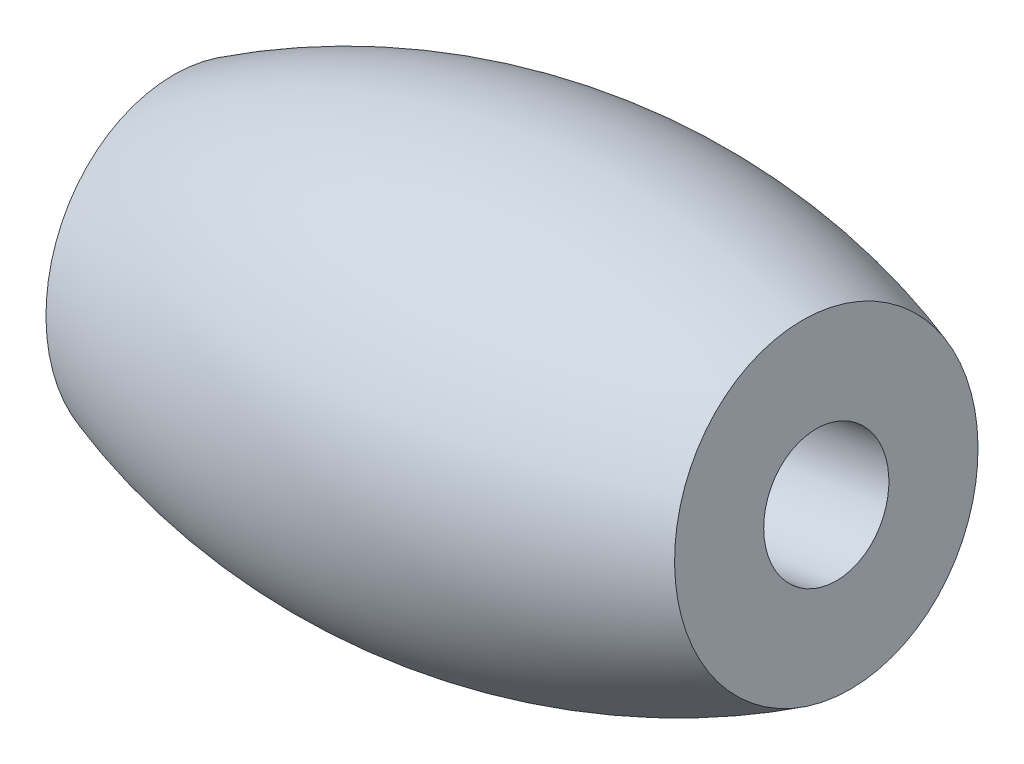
SolidWorks part; units mm, degrees
ref_plane "Plan de face" through (0, 0, 0) normal (0, 0, 1) x (1, 0, 0)
ref_plane "Plan de dessus" through (0, 0, 0) normal (0, 1, 0) x (1, 0, 0)
ref_plane "Plan de droite" through (0, 0, 0) normal (1, 0, 0) x (0, 0, -1)
sketch "Esquisse2" plane through (0, 0, 0) normal (0, 0, 1) x (1, 0, 0)
  line L1 (-28.3539, 9.813) -> (2.2832, 14.7694) construction
  line L2 (-21.6897, 12.5625) -> (-22.065, 14.8824)
  line L3 (-13.0353, 12.2912) -> (-15.6079, 28.1927) construction
  line L4 (-4.9079, 15.2775) -> (-5.2832, 17.5973)
  line L5 (-21.6897, 12.5625) -> (-4.9079, 15.2775)
  line L6 (-21.5918, 8.8259) -> (-22.4553, 14.164) construction
  line L8 (-26.0707, 8.6628) -> (-21.6803, 9.3731) construction
  line L9 (-22.1594, 12.3346) -> (-25.888, 11.7314) construction
  arc A0 (-22.065, 14.8824) -> (-5.2832, 17.5973) centre (-10.5029, -3.3625) cw
  spline S0 degree 3 number of poles 82 (-1.8473, -17.8124) -> (-1.8473, 17.8124) construction
revolve "Révolution1" add sketch "Esquisse2" angle 360 about L1
equation "\"D1@Esquisse2\"=\"diametre@roue mecanum2-1.Part\"/2-1"
equation "\"D2@Esquisse2\"=\"diametre@roue mecanum2-1.Part\"/4-1"
equation "\"D3@Esquisse2\"=\"diametre@roue mecanum2-1.Part\"*0.6"
equation "\"D4@Esquisse2\"=\"diametre@roue mecanum2-1.Part\"/\"diametre@roue mecanum2-1.Part\"*3+0.3"
equation "\"D5@Esquisse2\" =  ( \"diametre@roue mecanum2<1>.Part\" / \"diametre@roue mecanum2<1>.Part\" )  / 2"
